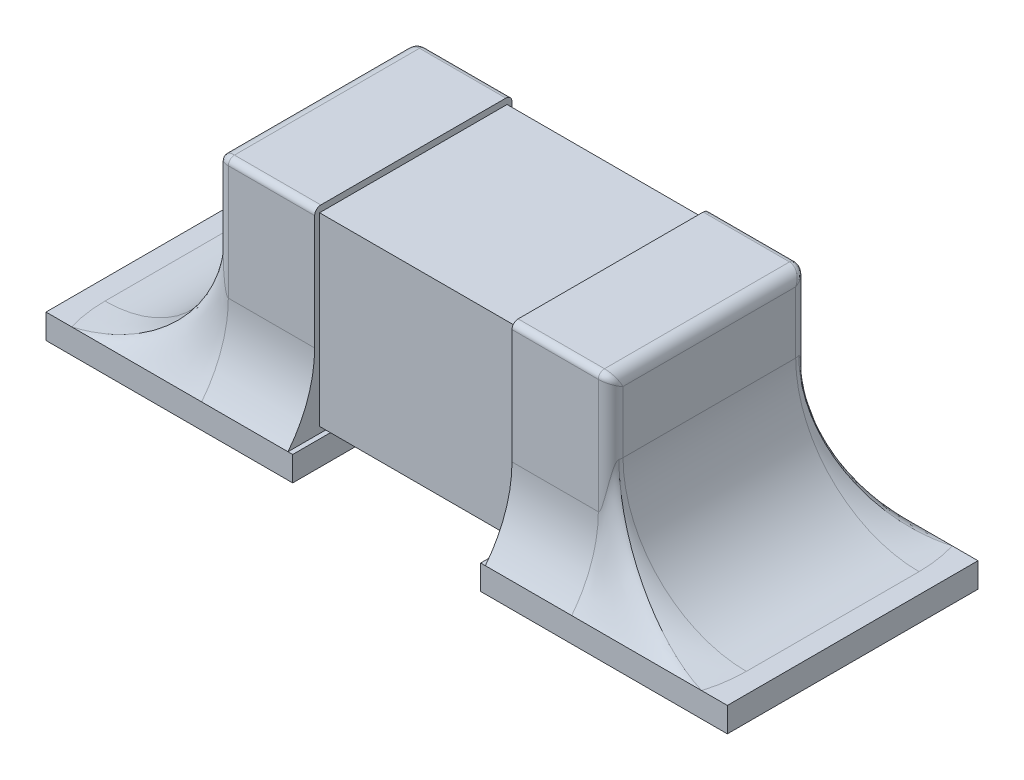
SolidWorks part; units mm, degrees
ref_plane "Front Plane" through (0, 0, 0) normal (0, 0, 1) x (1, 0, 0)
ref_plane "Top Plane" through (0, 0, 0) normal (0, 1, 0) x (1, 0, 0)
ref_plane "Right Plane" through (0, 0, 0) normal (1, 0, 0) x (0, 0, -1)
sketch "Sketch1" plane through (0, 0, 0) normal (1, 0, 0) x (0, 0, -1)
  line L0 (55, 0) -> (-55, 0) construction
  line L1 (-0.38, 0.125) -> (0.38, 0.125)
  line L2 (-0.38, 0.125) -> (-0.38, 0.875)
  line L3 (-0.38, 0.875) -> (0.38, 0.875)
  line L4 (0.38, 0.125) -> (0.38, 0.875)
  line L5 (0, 55) -> (0, -55) construction
  dimension "D1" = 0.76
  dimension "D2" = 0.75
  dimension "D3" = 0.125
  dimension "D4" = 0.38
extrude "Boss-Extrude1" add sketch "Sketch1" along normal mid plane 0.8
sketch "Sketch3" plane through (0.4, 0, 0) normal (1, 0, 0) x (0, 0, -1)
  line L0 (0, 0.44) -> (0, -0.44) construction
  line L1 (-0.375, 0.9) -> (0.375, 0.9)
  line L2 (-0.4, 0.875) -> (-0.4, 0.1)
  line L3 (-0.4, 0.1) -> (0.4, 0.1)
  line L4 (0.4, 0.875) -> (0.4, 0.1)
  line L6 (0.44, 0) -> (-0.44, 0) construction
  arc A2 (0.375, 0.9) -> (0.4, 0.875) centre (0.375, 0.875) cw
  arc A3 (-0.375, 0.9) -> (-0.4, 0.875) centre (-0.375, 0.875) ccw
  point P15 (0.4, 0.9)
  point P18 (-0.4, 0.9)
  dimension "D5" = 0.025
  dimension "D1" = 0.8
  dimension "D2" = 0.4
  dimension "D3" = 0.8
  dimension "D4" = 0.1
extrude "Boss-Extrude2" add sketch "Sketch3" along normal blind 0.4
sketch "Sketch5" plane through (-0.4, 0, 0) normal (-1, 0, 0) x (0, 0, 1)
  line L0 (0.375, 0.9) -> (-0.375, 0.9) construction
  line L1 (-0.375, 0.9) -> (0.375, 0.9)
  line L2 (-0.4, 0.875) -> (-0.4, 0.1)
  line L3 (-0.4, 0.1) -> (0.4, 0.1)
  line L4 (0.4, 0.875) -> (0.4, 0.1)
  line L5 (0.4, 0.875) -> (0.4, 0.1) construction
  line L6 (0.4, 0.1) -> (-0.4, 0.1) construction
  line L7 (-0.4, 0.875) -> (-0.4, 0.1) construction
  arc A2 (0.375, 0.9) -> (0.4, 0.875) centre (0.375, 0.875) cw
  arc A3 (-0.375, 0.9) -> (-0.4, 0.875) centre (-0.375, 0.875) ccw
  dimension "D1" = 0.025
extrude "Boss-Extrude3" add sketch "Sketch5" along normal blind 0.4
sketch "Sketch6" plane through (0, 0, 0) normal (0, 1, 0) x (1, 0, 0)
  line L0 (0, -0.44) -> (0, 0.44) construction
  line L1 (-1.381, 0.508) -> (-0.381, 0.508)
  line L2 (-1.381, 0.508) -> (-1.381, -0.508)
  line L3 (-1.381, -0.508) -> (-0.381, -0.508)
  line L4 (-0.381, 0.508) -> (-0.381, -0.508)
  line L5 (-0.44, 0) -> (0.44, 0) construction
  line L7 (0.381, 0.508) -> (1.381, 0.508)
  line L8 (0.381, 0.508) -> (0.381, -0.508)
  line L9 (0.381, -0.508) -> (1.381, -0.508)
  line L10 (1.381, 0.508) -> (1.381, -0.508)
  dimension "D1" = 1
  dimension "D2" = 1.016
  dimension "D3" = 0.381
  dimension "D4" = 0.508
  dimension "D5" = 0.381
extrude "Boss-Extrude4" add sketch "Sketch6" along normal blind 0.1
fillet "Fillet3" radius 0.05 10 edges at (0.8, 0.4875, 0.4) (0.8, 0.8927, 0.3927) (0.8, 0.9, 0) (0.8, 0.8927, -0.3927) (-0.8, 0.4875, 0.4) (-0.8, 0.8927, 0.3927) (-0.8, 0.9, 0) (-0.8, 0.8927, -0.3927) (0.8, 0.4875, -0.4) (-0.8, 0.4875, -0.4)
fillet "Fillet5" radius 0.5 10 edges at (0.575, 0.1, 0.4) (0.7854, 0.1, 0.3854) (0.8, 0.1, 0) (0.7854, 0.1, -0.3854) (-0.575, 0.1, 0.4) (-0.7854, 0.1, 0.3854) (-0.8, 0.1, 0) (-0.7854, 0.1, -0.3854) (0.575, 0.1, -0.4) (-0.575, 0.1, -0.4)
